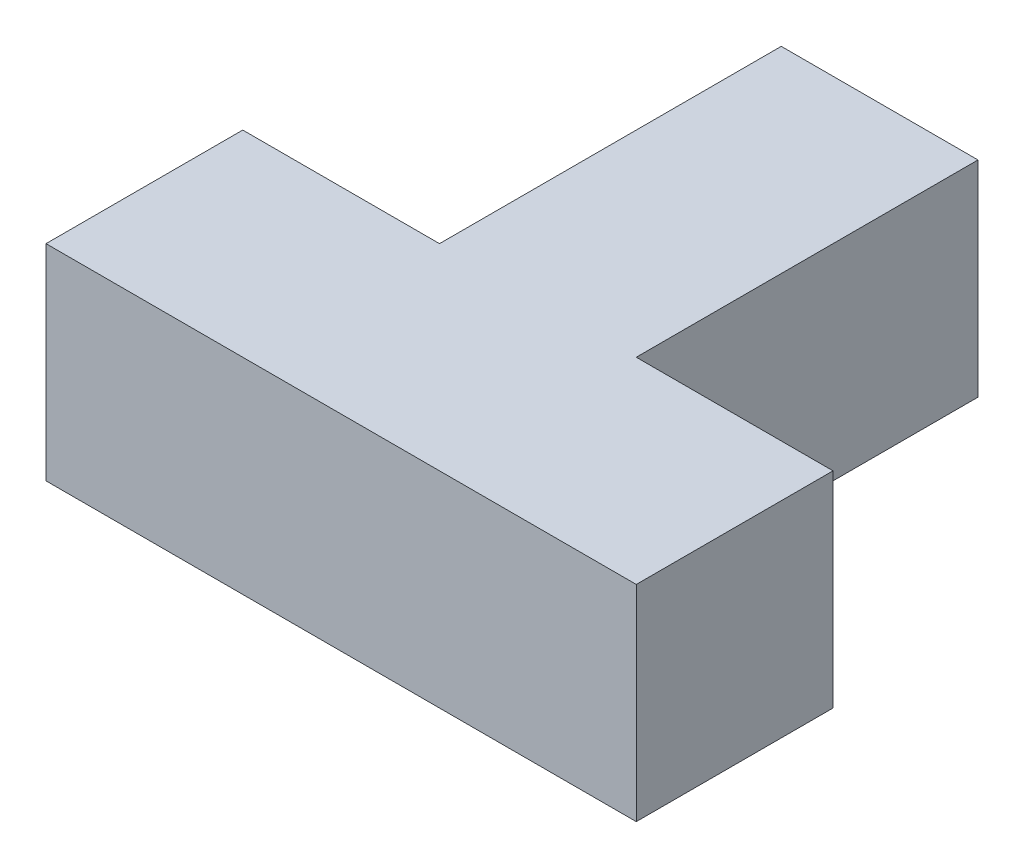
SolidWorks part; units mm, degrees
ref_plane "Plane1" through (0, 0, 0) normal (0, 0, 1) x (1, 0, 0)
ref_plane "Plane2" through (0, 0, 0) normal (0, 1, 0) x (1, 0, 0)
ref_plane "Plane3" through (0, 0, 0) normal (1, 0, 0) x (0, 0, -1)
sketch "Sketch1" plane through (0, 0, 0) normal (0, 1, 0) x (1, 0, 0)
  line L0 (0, 0) -> (71.8267, 0)
  line L1 (71.8267, 0) -> (71.8267, 23.9422)
  line L2 (71.8267, 23.9422) -> (47.8844, 23.9422)
  line L3 (47.8844, 23.9422) -> (47.8844, 65.5261)
  line L4 (47.8844, 65.5261) -> (23.9422, 65.5261)
  line L5 (23.9422, 65.5261) -> (23.9422, 23.9422)
  line L6 (23.9422, 23.9422) -> (0, 23.9422)
  line L7 (0, 23.9422) -> (0, 0)
extrude "Base-Extrude" add sketch "Sketch1" along normal blind 25
